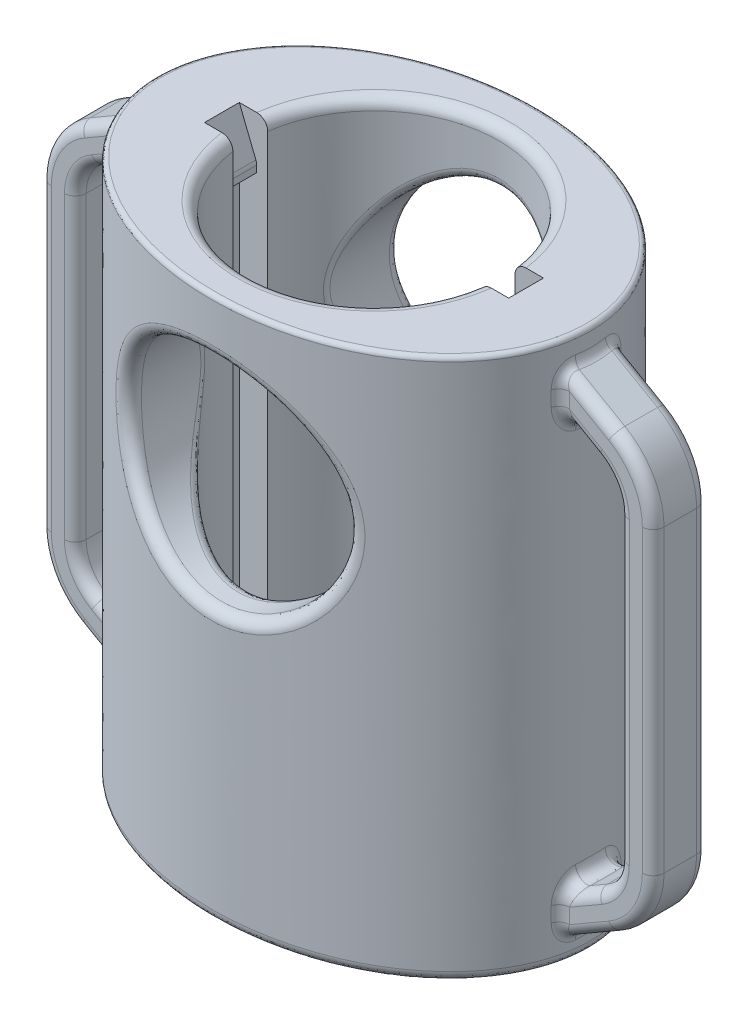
SolidWorks part; units mm, degrees
ref_plane "Front" through (0, 0, 0) normal (0, 0, 1) x (1, 0, 0)
ref_plane "Top" through (0, 0, 0) normal (0, 1, 0) x (1, 0, 0)
ref_plane "Right" through (0, 0, 0) normal (1, 0, 0) x (0, 0, -1)
sketch "Sketch1" plane through (0, 0, 0) normal (0, 1, 0) x (1, 0, 0)
  ellipse E0 centre (0, 0) end of major axis (12.7, 0) minor radius 9.525
  dimension "D1" = 19.05
  dimension "D2" = 25.4
extrude "Extrude1" add sketch "Sketch1" against normal blind 31.75
sketch "Sketch2" plane through (0, 0, 0) normal (0, 1, 0) x (-1, 0, 0)
  line L0 (0, 0) -> (0, -10.5334) construction
  line L1 (-7.2315, -1.016) -> (-8.89, -1.016)
  line L2 (7.2315, -1.016) -> (8.89, -1.016)
  line L3 (-8.89, -1.016) -> (-8.89, 1.016)
  line L4 (8.89, -1.016) -> (8.89, 1.016)
  line L5 (-8.89, 1.016) -> (-7.2315, 1.016)
  line L6 (8.89, 1.016) -> (7.2315, 1.016)
  line L7 (0, 0) -> (-13.1989, 0) construction
  arc A0 (-7.2315, -1.016) -> (7.2315, -1.016) centre (0, 0) ccw
  arc A1 (7.2315, 1.016) -> (-7.2315, 1.016) centre (0, 0) ccw
  dimension "D1" = 14.605
  dimension "D2" = 8.89
  dimension "D3" = 2.032
extrude "Cut-Extrude1" cut sketch "Sketch2" against normal blind 28.575
sketch "Sketch3" plane through (0, 0, 0) normal (0, 0, 1) x (1, 0, 0)
  line L0 (12.7, 0) -> (-12.7, 0) construction
  line L1 (0, -9.525) -> (0, 0) construction
  circle A0 centre (0, -9.525) radius 6.35
  dimension "D1" = 12.7
  dimension "D2" = 9.525
extrude "Cut-Extrude2" cut sketch "Sketch3" against normal through all and the other way through all
sketch "Sketch4" plane through (0, 0, 0) normal (0, 0, 1) x (1, 0, 0)
  line L0 (10.16, -2.3464) -> (14.605, -4.9127)
  line L2 (15.875, -7.1124) -> (15.875, -24.6376)
  line L3 (14.605, -26.8373) -> (10.16, -29.4036)
  line L4 (10.16, 0) -> (10.16, -2.3464)
  line L7 (15.621, -3.1529) -> (10.16, 0)
  line L8 (17.907, -7.1124) -> (17.907, -24.6376)
  line L9 (15.621, -28.5971) -> (10.16, -31.75)
  line L10 (10.16, -29.4036) -> (10.16, -31.75)
  line L11 (12.7, 0) -> (-12.7, 0) construction
  line L12 (-12.7, -31.75) -> (12.7, -31.75) construction
  line L13 (-12.7, -15.875) -> (12.7, -15.875) construction
  line L14 (-12.7, 0) -> (-12.7, -31.75) construction
  line L15 (12.7, -31.75) -> (12.7, 0) construction
  arc A0 (14.605, -4.9127) -> (15.875, -7.1124) centre (13.335, -7.1124) cw
  arc A1 (15.875, -24.6376) -> (14.605, -26.8373) centre (13.335, -24.6376) cw
  arc A2 (15.621, -3.1529) -> (17.907, -7.1124) centre (13.335, -7.1124) cw
  arc A3 (17.907, -24.6376) -> (15.621, -28.5971) centre (13.335, -24.6376) cw
  dimension "D6" = 2.54
  dimension "D7" = 4.572
  dimension "D1" = 2.032
  dimension "D2" = 2.032
  dimension "D3" = 15.875
  dimension "D4" = 30
  dimension "D5" = 10.16
extrude "Extrude2" add sketch "Sketch4" along normal mid plane 3.175
sketch "Sketch5" plane through (0, 0, 0) normal (0, 0, 1) x (1, 0, 0)
  line L0 (0, 0) -> (0, -13.8621) construction
  line L1 (7.874, -2.54) -> (8.89, 0)
  line L2 (-7.874, -2.54) -> (-7.874, -3.048)
  line L4 (-8.89, -3.048) -> (-8.89, 0)
  line L5 (7.874, -3.048) -> (8.89, -3.048)
  line L6 (-7.874, -3.048) -> (-8.89, -3.048)
  line L7 (8.89, -3.048) -> (8.89, 0)
  line L8 (12.7, 0) -> (-12.7, 0) construction
  line L9 (-8.89, 0) -> (-7.874, -2.54)
  line L12 (7.874, -2.54) -> (7.874, -3.048)
  dimension "D2" = 3.048
  dimension "D3" = 1.016
  dimension "D4" = 0.508
extrude "Extrude3" add sketch "Sketch5" along normal up to surface and the other way up to surface
mirror "Mirror1" about plane through (0, 0, 0) normal (1, 0, 0) of "Extrude2"
sketch "Sketch6"
  line L0 (0, 0) -> (-14.3394, 0) construction
  line L1 (-3.4641, 7.493) -> (3.4641, 7.493)
  line L2 (-7.7209, -1.651) -> (7.7209, -1.651)
  line L3 (-3.4641, 6.223) -> (3.4641, 6.223)
  line L4 (-7.7209, -2.921) -> (7.7209, -2.921)
  line L5 (-6.4056, 5.207) -> (6.4056, 5.207)
  line L6 (-6.4056, -3.937) -> (6.4056, -3.937)
  line L7 (-6.4056, 3.937) -> (6.4056, 3.937)
  line L8 (-6.4056, -5.207) -> (6.4056, -5.207)
  line L9 (-7.7209, 2.921) -> (7.7209, 2.921)
  line L10 (-3.4641, -6.223) -> (3.4641, -6.223)
  line L11 (-7.7209, 1.651) -> (7.7209, 1.651)
  line L12 (-3.4641, -7.493) -> (3.4641, -7.493)
  line L13 (-8.2305, 0.635) -> (8.2305, 0.635)
  line L15 (-8.2305, -0.635) -> (8.2305, -0.635)
  circle A0 centre (0, 0) radius 8.255 construction
  arc A1 (3.4641, 7.493) -> (3.4641, 6.223) centre (3.4641, 6.858) cw
  arc A2 (6.4056, 5.207) -> (6.4056, 3.937) centre (6.4056, 4.572) cw
  arc A3 (7.7209, 2.921) -> (7.7209, 1.651) centre (7.7209, 2.286) cw
  arc A4 (8.2305, 0.635) -> (8.2305, -0.635) centre (8.2305, 0) cw
  arc A5 (-3.4641, 7.493) -> (-3.4641, 6.223) centre (-3.4641, 6.858) ccw
  arc A6 (-6.4056, 5.207) -> (-6.4056, 3.937) centre (-6.4056, 4.572) ccw
  arc A7 (-7.7209, 2.921) -> (-7.7209, 1.651) centre (-7.7209, 2.286) ccw
  arc A8 (-8.2305, 0.635) -> (-8.2305, -0.635) centre (-8.2305, 0) ccw
  arc A9 (-7.7209, -2.921) -> (-7.7209, -1.651) centre (-7.7209, -2.286) cw
  arc A10 (-6.4056, -5.207) -> (-6.4056, -3.937) centre (-6.4056, -4.572) cw
  arc A11 (-3.4641, -7.493) -> (-3.4641, -6.223) centre (-3.4641, -6.858) cw
  arc A12 (7.7209, -2.921) -> (7.7209, -1.651) centre (7.7209, -2.286) ccw
  arc A13 (6.4056, -5.207) -> (6.4056, -3.937) centre (6.4056, -4.572) ccw
  arc A14 (3.4641, -7.493) -> (3.4641, -6.223) centre (3.4641, -6.858) ccw
  dimension "D5" = 16.51
  dimension "D1" = 1.016
  dimension "D2" = 1.016
  dimension "D3" = 1.016
  dimension "D4" = 1.27
fillet "Fillet1" radius 0.635 65 edges at (13.5637, -4.3115, -1.5875) (15.5347, -5.8424, -1.5875) (13.5637, -27.4385, -1.5875) (15.5347, -25.9076, -1.5875) (14.0717, -29.4916, -1.5875) (17.2945, -26.9236, -1.5875) (14.0717, -2.2584, -1.5875) (17.2945, -4.8264, -1.5875) (14.0717, -29.4916, 1.5875) (17.2945, -26.9236, 1.5875) (14.0717, -2.2584, 1.5875) (17.2945, -4.8264, 1.5875) (13.5637, -4.3115, 1.5875) (15.5347, -5.8424, 1.5875) (13.5637, -27.4385, 1.5875) (15.5347, -25.9076, 1.5875) (0, 0, -7.3025) (0, 0, 7.3025) (-7.874, -2.54, 0) (15.875, -15.875, -1.5875) (17.907, -15.875, -1.5875) (17.907, -15.875, 1.5875) (15.875, -15.875, 1.5875) (12.7, -31.75, 0) (-13.5637, -27.4385, -1.5875) (-15.5347, -25.9076, -1.5875) (-15.875, -15.875, -1.5875) (-15.5347, -5.8424, -1.5875) (-14.0717, -29.4916, -1.5875) (-17.2945, -26.9236, -1.5875) (-17.907, -15.875, -1.5875) (-17.2945, -4.8264, -1.5875) (-13.5637, -27.4385, 1.5875) (-15.5347, -25.9076, 1.5875) (-15.875, -15.875, 1.5875) (-15.5347, -5.8424, 1.5875) (-14.0717, -29.4916, 1.5875) (-17.2945, -26.9236, 1.5875) (-17.907, -15.875, 1.5875) (-17.2945, -4.8264, 1.5875) (-13.5637, -4.3115, -1.5875) (-14.0717, -2.2584, -1.5875) (-13.5637, -4.3115, 1.5875) (-14.0717, -2.2584, 1.5875) (-6.3126, -8.8369, -3.6712) (-0.9505, -15.8035, -9.4983) (-6.2753, -10.4965, 8.281) (-6.3126, -10.2131, 3.6712) (-12.681, -3.8019, 0.5208) (-12.5224, -2.5371, -1.5875) (-12.681, -1.4555, -0.5208) (-12.5224, -2.5371, 1.5875) (12.5224, -2.5371, -1.5875) (12.6783, -3.8003, -0.5564) (12.6783, -1.4539, 0.5564) (12.5224, -2.5371, 1.5875) (12.5224, -29.2129, -1.5875) (12.6783, -27.9497, 0.5564) (12.6783, -30.2961, -0.5564) (12.5224, -29.2129, 1.5875) (-12.5224, -29.2129, -1.5875) (-12.681, -27.9481, -0.5208) (-12.681, -30.2945, 0.5208) (-12.5224, -29.2129, 1.5875) (7.874, -2.54, 0)
extrude "Extrude4" add sketch "Sketch6" along normal blind 0.2794
fillet "Fillet2" radius 0.254 29 edges at (-4.0991, -32.0294, 6.858) (0, -32.0294, 7.493) (4.0991, -32.0294, 6.858) (-7.0406, -32.0294, 4.572) (0, -32.0294, 5.207) (7.0406, -32.0294, 4.572) (-8.3559, -32.0294, 2.286) (0, -32.0294, 2.921) (8.3559, -32.0294, 2.286) (-8.8655, -32.0294, 0) (0, -32.0294, 0.635) (8.8655, -32.0294, 0) (-8.3559, -32.0294, -2.286) (0, -32.0294, -1.651) (8.3559, -32.0294, -2.286) (-7.0406, -32.0294, -4.572) (0, -32.0294, -3.937) (7.0406, -32.0294, -4.572) (-4.0991, -32.0294, -6.858) (0, -32.0294, -6.223) (4.0991, -32.0294, -6.858) (0, -32.0294, 6.223) (0, -32.0294, 3.937) (0, -32.0294, 1.651) (0, -32.0294, -0.635) (0, -32.0294, -2.921) (0, -32.0294, -5.207) (0, -32.0294, -7.493) (12.7, 0, 0)
